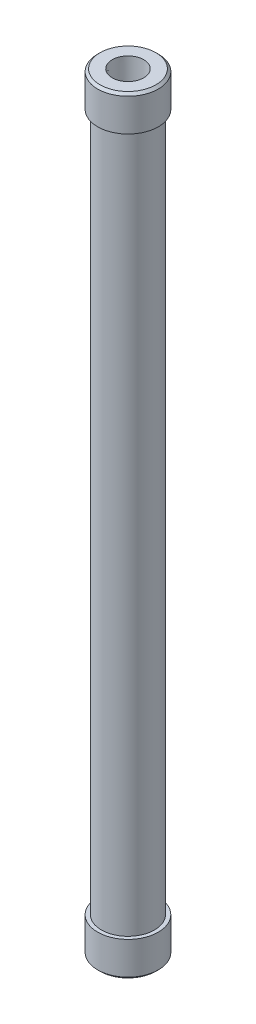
SolidWorks part; units mm, degrees
ref_plane "Front Plane" through (0, 0, 0) normal (0, 0, 1) x (1, 0, 0)
ref_plane "Top Plane" through (0, 0, 0) normal (0, 1, 0) x (1, 0, 0)
ref_plane "Right Plane" through (0, 0, 0) normal (1, 0, 0) x (0, 0, -1)
sketch "Sketch1" plane through (0, 0, 0) normal (0, 1, 0) x (1, 0, 0)
  circle A0 centre (0, 0) radius 16.7005
  circle A1 centre (0, 0) radius 13.1445
  dimension "D1" = 33.401
  dimension "D2" = 3.556
extrude "Boss-Extrude1" add sketch "Sketch1" along normal blind 482.6
sketch "Sketch2" plane through (0, 0, 0) normal (0, 1, 0) x (1, 0, 0)
  circle A0 centre (0, 0) radius 19.05
  dimension "D1" = 38.1
extrude "Boss-Extrude2" add sketch "Sketch2" along normal blind 22.098
ref_plane "Plane1" through (0, 482.6, 0) normal (0, 1, 0) x (1, 0, 0)
sketch "Sketch3" plane through (0, 482.6, 0) normal (0, 1, 0) x (1, 0, 0)
  circle A0 centre (0, 0) radius 19.05
  dimension "D1" = 38.1
extrude "Boss-Extrude3" add sketch "Sketch3" against normal blind 22.098
hole_wizard "1/2 Rc Tapped Hole1" positions "Sketch6" profile "Sketch5" size "1/2" standard "BSI"
sketch "Sketch6" plane through (0, 0, 0) normal (0, -1, 0) x (-1, 0, 0)
  point P0 (0, 0)
sketch "Sketch5" plane through (0, 0, 0) normal (1, 0, 0) x (0, 0, -1)
  line L0 (0, 0) -> (0, 29.3875)
  line L1 (8.75, 24.13) -> (0, 29.3875)
  line L2 (-8.75, 24.13) -> (0, 29.3875) construction
  line L3 (8.75, 24.13) -> (8.75, 14.986)
  line L4 (8.75, 14.986) -> (9.4283, 14.986)
  line L5 (9.4283, 14.986) -> (9.8961, 0)
  line L6 (-9.4283, 14.986) -> (-9.8961, 0) construction
  line L7 (9.8961, 0) -> (0, 0)
  line L8 (0, -6.35) -> (0, 107.95) construction
  line L11 (-8.75, 14.986) -> (-9.4283, 14.986) construction
  dimension "Tap Drill Dia." = 17.5
  dimension "Tap Drill Depth" = 24.13
  dimension "Thread Dia." = 19.7921
  dimension "Thread Angle" = 3.576
  dimension "Thread Depth" = 14.986
  dimension "Drill Angle" = 118
hole_wizard "1/2 Rc Tapped Hole2" positions "Sketch8" profile "Sketch7" size "1/2" standard "BSI"
sketch "Sketch8" plane through (0, 482.6, 0) normal (0, 1, 0) x (1, 0, 0)
  point P0 (0, 0)
sketch "Sketch7" plane through (0, 482.6, 0) normal (1, 0, 0) x (0, 0, 1)
  line L0 (0, 0) -> (0, 29.3875)
  line L1 (8.75, 24.13) -> (0, 29.3875)
  line L2 (-8.75, 24.13) -> (0, 29.3875) construction
  line L3 (8.75, 24.13) -> (8.75, 14.986)
  line L4 (8.75, 14.986) -> (9.4283, 14.986)
  line L5 (9.4283, 14.986) -> (9.8961, 0)
  line L6 (-9.4283, 14.986) -> (-9.8961, 0) construction
  line L7 (9.8961, 0) -> (0, 0)
  line L8 (0, -6.35) -> (0, 107.95) construction
  line L11 (-8.75, 14.986) -> (-9.4283, 14.986) construction
  dimension "Tap Drill Dia." = 17.5
  dimension "Tap Drill Depth" = 24.13
  dimension "Thread Dia." = 19.7921
  dimension "Thread Angle" = 3.576
  dimension "Thread Depth" = 14.986
  dimension "Drill Angle" = 118
chamfer "Chamfer2" distance 1.524 angle 45 2 edges at (0, 0, 19.05) (0, 482.6, 19.05)
